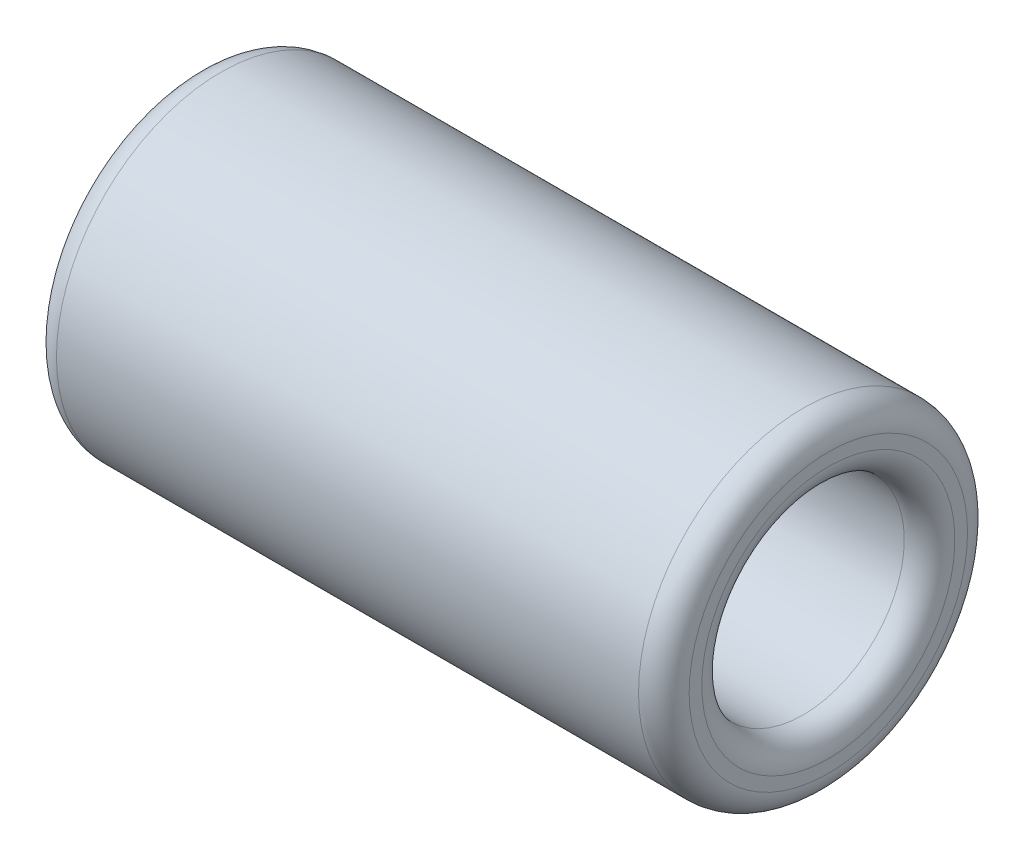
SolidWorks part; units mm, degrees
ref_plane "Plan de face" through (0, 0, 0) normal (0, 0, 1) x (1, 0, 0)
ref_plane "Plan de dessus" through (0, 0, 0) normal (0, 1, 0) x (1, 0, 0)
ref_plane "Plan de droite" through (0, 0, 0) normal (1, 0, 0) x (0, 0, -1)
sketch "Esquisse1" plane through (0, 0, 0) normal (0, 0, 1) x (1, 0, 0)
  line L0 (0, 0) -> (10.3209, 0) construction
  line L2 (0.4, 1.6) -> (9.6, 1.6)
  line L3 (0, 2) -> (0, 2.2)
  line L4 (0.4, 2.6) -> (9.6, 2.6)
  line L5 (10, 2) -> (10, 2.2)
  arc A0 (0.4, 1.6) -> (0, 2) centre (0.4, 2) cw
  arc A1 (0, 2.2) -> (0.4, 2.6) centre (0.4, 2.2) cw
  arc A2 (9.6, 2.6) -> (10, 2.2) centre (9.6, 2.2) cw
  arc A3 (9.6, 1.6) -> (10, 2) centre (9.6, 2) ccw
  dimension "D4" = 0.4
  dimension "D1" = 3.2
  dimension "D2" = 5.2
  dimension "D3" = 10
revolve "Révolution1" add sketch "Esquisse1" angle 360 about L0
